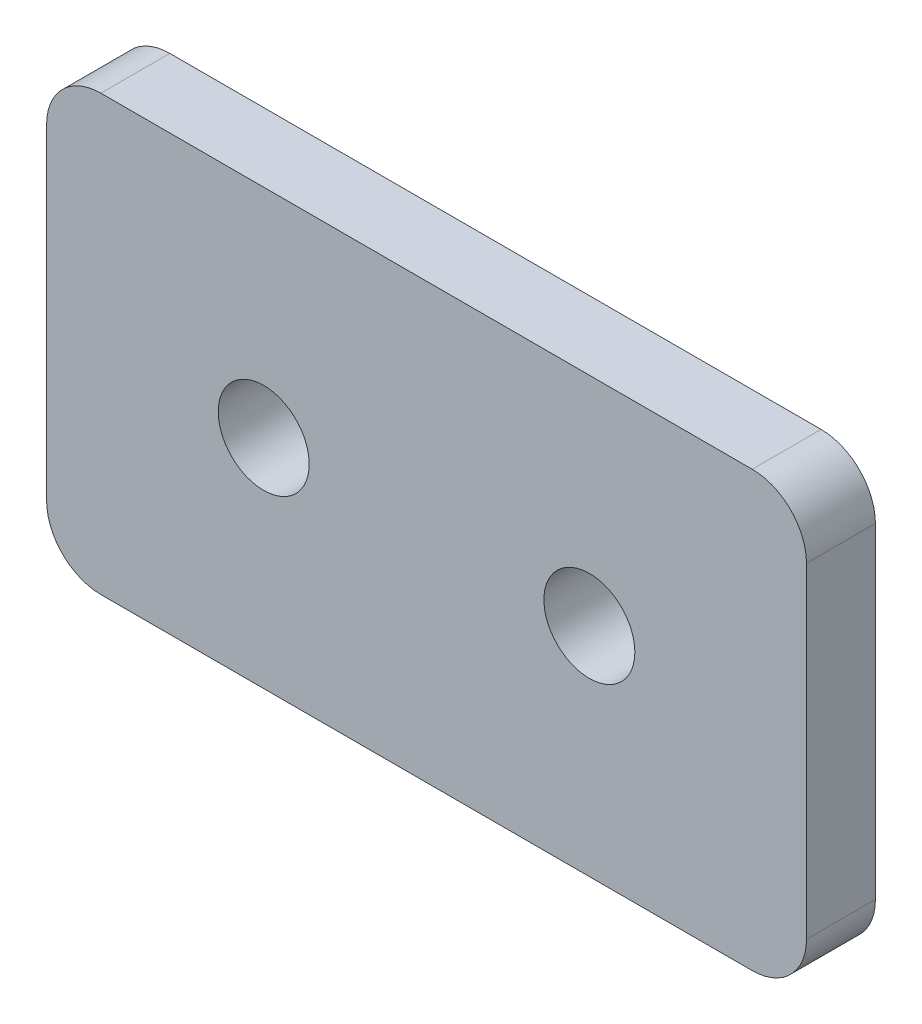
SolidWorks part; units mm, degrees
ref_plane "Front Plane" through (0, 0, 0) normal (0, 0, 1) x (1, 0, 0)
ref_plane "Top Plane" through (0, 0, 0) normal (0, 1, 0) x (1, 0, 0)
ref_plane "Right Plane" through (0, 0, 0) normal (1, 0, 0) x (0, 0, -1)
sketch "Sketch1" plane through (0, 0, 0) normal (0, 0, 1) x (1, 0, 0)
  line L4 (-9.5, 10) -> (-2.88, 10) construction
  line L5 (-10, 9.5) -> (-10, 2.88) construction
  line L6 (-10, -9.5) -> (-10, -2.88) construction
  line L7 (-9.5, -10) -> (-2.88, -10) construction
  line L12 (-9.5, 10) -> (-2.88, 10) construction
  line L13 (-10, 9.5) -> (-10, 2.88) construction
  line L14 (-10, -9.5) -> (-10, -2.88) construction
  line L15 (-9.5, -10) -> (-2.88, -10) construction
  line L16 (-10, 9.5) -> (-10, 10) construction
  line L17 (-10, 10) -> (-9.5, 10) construction
  line L19 (-10, 10) -> (25, 10)
  line L20 (-10, 10) -> (-10, -10)
  line L21 (-10, -10) -> (25, -10)
  line L22 (25, 10) -> (25, -10)
  line L26 (0, 0) -> (25, 0) construction
  arc A0 (-9.5, 10) -> (-10, 9.5) centre (-9.5, 9.5) ccw construction
  arc A1 (-10, -9.5) -> (-9.5, -10) centre (-9.5, -9.5) ccw construction
  arc A2 (-9.5, 10) -> (-10, 9.5) centre (-9.5, 9.5) ccw construction
  arc A3 (-10, -9.5) -> (-9.5, -10) centre (-9.5, -9.5) ccw construction
  circle A4 centre (0, 0) radius 2.095 construction
  circle A5 centre (0, 0) radius 2.095
  circle A6 centre (15, 0) radius 2.095
  dimension "D1" = 4.19
  dimension "D3" = 15
  dimension "D5" = 35
extrude "Boss-Extrude2" add sketch "Sketch1" along normal blind 3.175
fillet "Fillet2" radius 2.5 4 edges at (25, -10, 1.5875) (25, 10, 1.5875) (-10, 10, 1.5875) (-10, -10, 1.5875)
